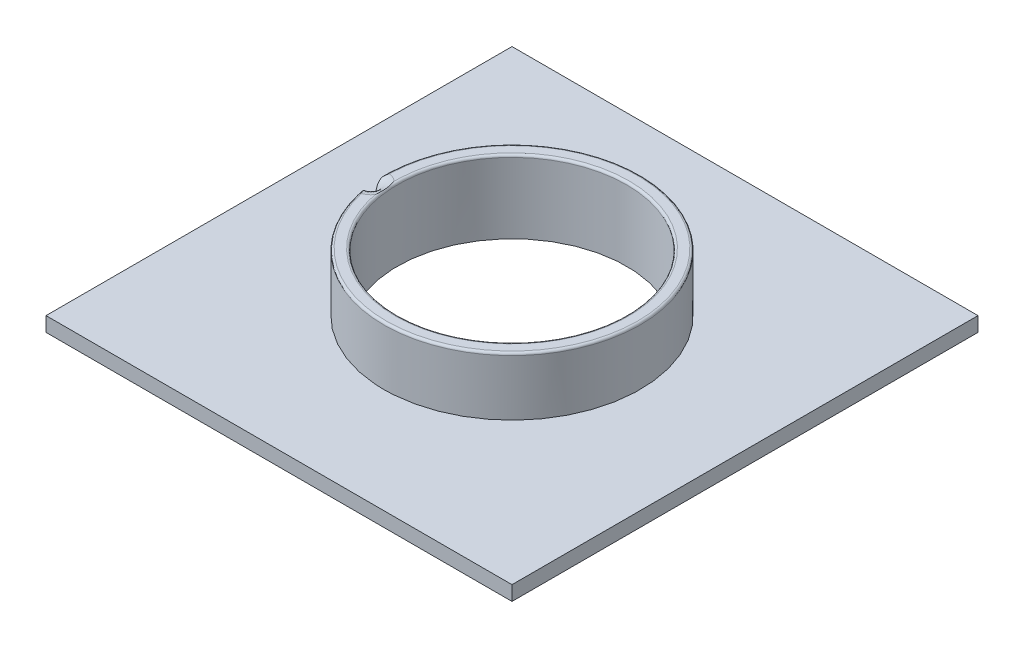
SolidWorks part; units mm, degrees
ref_plane "Front" through (0, 0, 0) normal (0, 0, 1) x (1, 0, 0)
ref_plane "Top" through (0, 0, 0) normal (0, 1, 0) x (1, 0, 0)
ref_plane "Right" through (0, 0, 0) normal (1, 0, 0) x (0, 0, -1)
sketch "Sketch1" plane through (0, 0, 0) normal (0, 1, 0) x (1, 0, 0)
  line L1 (-50.8, -50.8) -> (50.8, -50.8)
  line L2 (-50.8, -50.8) -> (-50.8, 50.8)
  line L3 (-50.8, 50.8) -> (50.8, 50.8)
  line L4 (50.8, -50.8) -> (50.8, 50.8)
  line L5 (-50.8, -50.8) -> (50.8, 50.8) construction
  line L6 (-50.8, 50.8) -> (50.8, -50.8) construction
  point P0 (0, 0)
  dimension "D1" = 101.6
  dimension "D2" = 101.6
extrude "Boss-Extrude1" add sketch "Sketch1" along normal blind 3.175
sketch "Sketch2" plane through (0, 3.175, 0) normal (0, 1, 0) x (1, 0, 0)
  circle A0 centre (0, 0) radius 25.4 construction
  circle A1 centre (0, 0) radius 27.94
  dimension "D1" = 50.8
  dimension "D2" = 2.54
extrude "Boss-Extrude2" add sketch "Sketch2" along normal blind 12.7
sketch "Sketch4" plane through (0, 0, 0) normal (1, 0, 0) x (0, 0, -1)
  line L0 (0, 15.875) -> (0, 3.175) construction
  line L1 (27.94, 15.875) -> (-27.94, 15.875) construction
  line L2 (50.8, 3.175) -> (-50.8, 3.175) construction
  line L3 (0, 9.525) -> (27.94, 9.525) construction
  line L4 (27.94, 3.175) -> (27.94, 15.875) construction
sketch "Sketch5" plane through (0, 0, 0) normal (0, 0, 1) x (1, 0, 0)
  line L0 (0, 9.525) -> (-27.94, 9.525) construction
  line L1 (0, 15.875) -> (0, 3.175) construction
  line L2 (-27.94, 15.875) -> (-27.94, 3.175) construction
  line L3 (-27.94, 9.525) -> (-27.94, 15.875) construction
  line L4 (27.94, 15.875) -> (-27.94, 15.875) construction
sketch3d "3DSketch3"
  line L0 (0, 9.525, 0) -> (0, 9.525, -27.94) construction
  line L1 (-13.0586, 9.525, -24.7006) -> (-13.0586, 9.144, -24.7006) construction
  line L2 (-8.2085, 9.525, -26.707) -> (-8.2085, 9.271, -26.707) construction
  arc A0 (-27.94, 9.525, 0) -> (0, 9.525, -27.94) centre (0, 9.525, 0) cw construction
  circle A2 centre (0, 15.875, 0) radius 27.94 construction
  spline S0 degree 3 poles (-27.94, 9.525, 0) (-27.8796, 8.6863, -16.6836) (-14.2581, 9.0609, -27.9899) (0, 9.525, -27.94) knots 0 0 0 0 1 1 1 1
  spline S1 degree 3 poles (-27.94, 9.525, 0) (-27.9279, 9.512, 3.1746) (-27.9941, 14.2371, 2.6779) (-27.788, 15.875, 2.9107) knots 0 0 0 0 1 1 1 1
  point P2 (0, -18.415, 0)
  point P13 (-8.2085, 9.398, -26.707)
  point P25 (0, 43.815, 0)
  dimension "D1" = 0.381
  dimension "D2" = 0.254
ref_plane "Plane2" through (-27.788, 15.875, 2.9107) normal (0.1236, 0.9825, 0.1396) x (0.9923, -0.1224, -0.0174)
sketch "Sketch7" plane through (-27.788, 15.875, 2.9107) normal (0.1236, 0.9825, 0.1396) x (0.9923, -0.1224, -0.0174)
  circle A0 centre (0, 0) radius 0.9525
  dimension "D1" = 1.905
sweep "Cut-Sweep1" cut profiles "Sketch7" path "3DSketch3"
fillet "Fillet1" radius 0.9398 2 edges at (0.0308, 8.574, -27.8972) (-0.0047, 9.5677, -26.9885)
fillet "Fillet2" radius 2.54 1 edges at (-26.8776, 15.875, 2.6208)
sketch "Sketch8" plane through (0, 15.875, 0) normal (0, 1, 0) x (1, 0, 0)
  circle A0 centre (0, 0) radius 25
  dimension "D1" = 50
extrude "Cut-Extrude1" cut sketch "Sketch8" against normal through all
fillet "Fillet3" radius 0.508 2 edges at (27.8064, 15.875, -2.7291) (24.8799, 15.875, -2.4474)
fillet "Fillet4" radius 0.127 3 edges at (-20.5877, 8.0761, -18.8889) (-19.059, 9.9907, -20.4303) (-0.016, 9.3048, -27.94)
